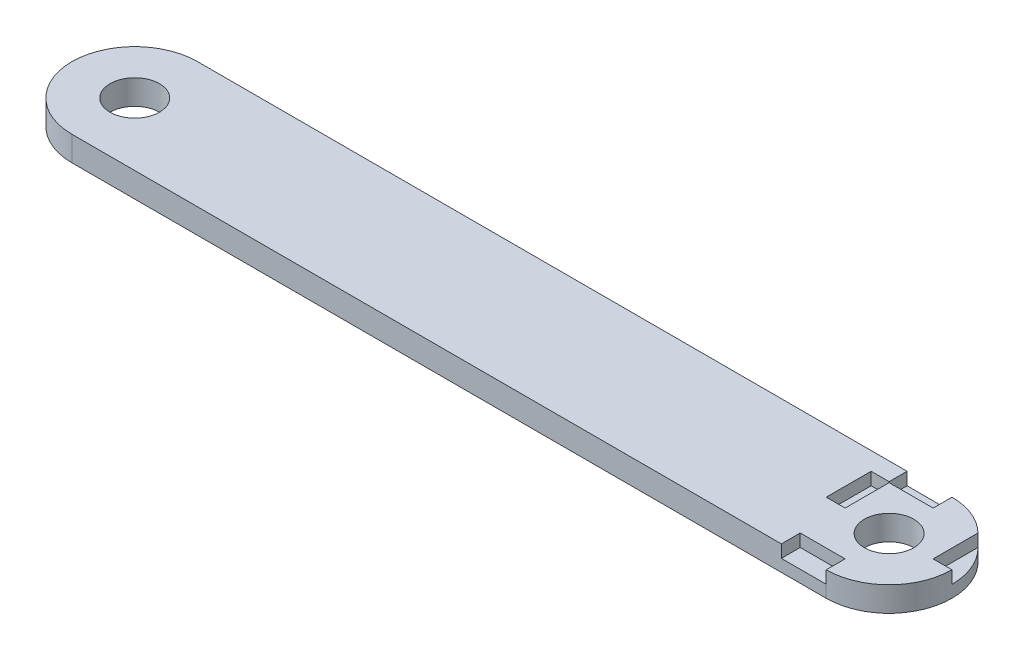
SolidWorks part; units mm, degrees
ref_plane "Front Plane" through (0, 0, 0) normal (0, 0, 1) x (1, 0, 0)
ref_plane "Top Plane" through (0, 0, 0) normal (0, 1, 0) x (1, 0, 0)
ref_plane "Right Plane" through (0, 0, 0) normal (1, 0, 0) x (0, 0, -1)
sketch "Sketch1" plane through (0, 0, 0) normal (0, 1, 0) x (1, 0, 0)
  line L0 (-73.5542, 11.3771) -> (78.8458, 11.3771)
  line L1 (-73.5542, -14.0229) -> (78.8458, -14.0229)
  arc A0 (-73.5542, -14.0229) -> (-73.5542, 11.3771) centre (-73.5542, -1.3229) cw
  arc A1 (78.8458, 11.3771) -> (78.8458, -14.0229) centre (78.8458, -1.3229) cw
  dimension "D2" = 12.7
  dimension "D1" = 152.4
extrude "Boss-Extrude1" add sketch "Sketch1" along normal blind 5
ref_point "Point3"
ref_point "Point4"
sketch "Sketch2" plane through (0, 0, 0) normal (0, 1, 0) x (1, 0, 0)
  circle A0 centre (-73.5542, -1.3229) radius 5
  circle A1 centre (78.8458, -1.3229) radius 5
  dimension "D1" = 10
  dimension "D2" = 10
extrude "Cut-Extrude1" cut sketch "Sketch2" along normal blind 5
sketch "Sketch3" plane through (0, 5, 0) normal (0, 1, 0) x (1, 0, 0)
  line L0 (78.8458, 11.3771) -> (-73.5542, 11.3771) construction
  line L1 (78.8458, 11.3771) -> (69.7762, 11.3771)
  line L2 (78.8458, 11.3771) -> (78.8458, 7.5671)
  line L3 (78.8458, 7.5671) -> (69.7762, 7.5671)
  line L4 (69.7762, 11.3771) -> (69.7762, 7.5671)
  line L5 (78.8458, -1.3229) -> (48.0476, -1.3229) construction
  line L6 (69.7762, -14.0229) -> (69.7762, -10.2129)
  line L7 (78.8458, -10.2129) -> (69.7762, -10.2129)
  line L8 (78.8458, -14.0229) -> (78.8458, -10.2129)
  line L9 (78.8458, -14.0229) -> (69.7762, -14.0229)
  arc A0 (78.8458, -14.0229) -> (78.8458, 11.3771) centre (78.8458, -1.3229) ccw construction
  arc A1 (78.8458, 11.3771) -> (69.7762, 7.5671) centre (78.8458, -1.3229) ccw construction
  dimension "D1" = 3.81
extrude "Cut-Extrude2" cut sketch "Sketch3" against normal blind 2.54
ref_axis "Axis1" through (78.8458, 0, 1.3229) along (0, 1, 0)
pattern_circular "CirPattern1" count 2 over 270 about axis through (78.8458, 0, 1.3229) along (0, 1, 0) of "Cut-Extrude2"
